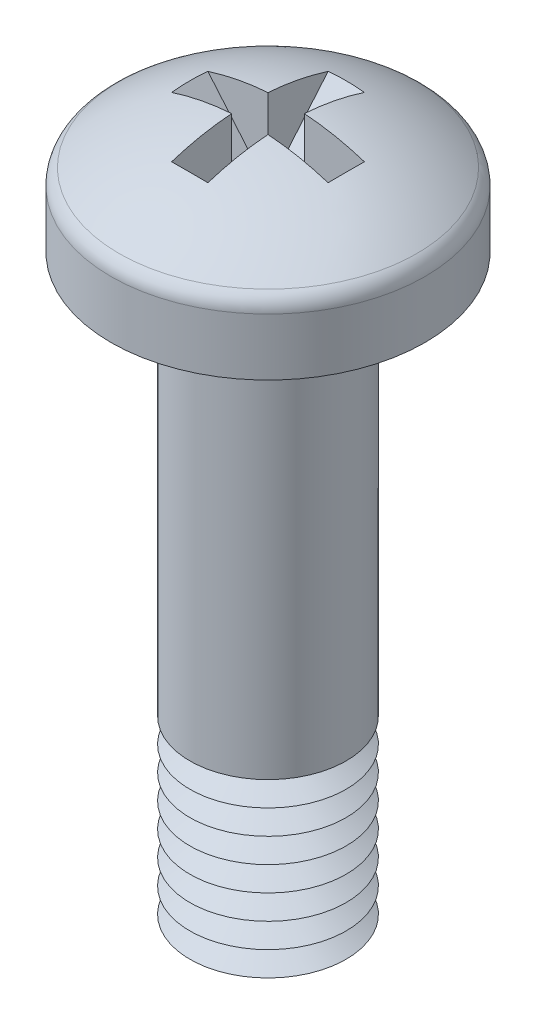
SolidWorks part; units mm, degrees
ref_plane "Front" through (0, 0, 0) normal (0, 0, 1) x (1, 0, 0)
ref_plane "Top" through (0, 0, 0) normal (0, 1, 0) x (1, 0, 0)
ref_plane "Side" through (0, 0, 0) normal (1, 0, 0) x (0, 0, -1)
sketch "Sketch1" plane through (0, 0, 0) normal (0, 0, 1) x (1, 0, 0)
  line L0 (0, 0) -> (4.0208, 0)
  line L1 (4.0208, 0) -> (4.0208, 1.4629)
  line L2 (0, 3.1) -> (0, 0)
  line L3 (0, 0) -> (0, 100) construction
  arc A0 (4.0208, 1.4629) -> (3.8128, 1.8691) centre (3.52, 1.4629) ccw
  arc A1 (3.8128, 1.8691) -> (0, 3.1) centre (0, -3.4208) ccw
revolve "Base-Revolve" add sketch "Sketch1" angle 360 about L3
sketch "Sketch2" plane through (0, 0, 0) normal (0, 0, 1) x (1, 0, 0)
  line L0 (0, 0) -> (0, 100) construction
  line L1 (0, -15) -> (1.456, -15)
  line L2 (1.456, -15) -> (2, -14.6859)
  line L3 (2, -14.6859) -> (1.456, -14.3718)
  line L4 (1.456, -14.3718) -> (2, -14.0577)
  line L5 (2, -14.0577) -> (1.456, -13.7436)
  line L6 (1.456, -13.7436) -> (2, -13.4295)
  line L7 (2, -13.4295) -> (1.456, -13.1154)
  line L8 (1.456, -13.1154) -> (2, -12.8012)
  line L9 (2, -12.8012) -> (1.456, -12.4871)
  line L10 (1.456, -12.4871) -> (2, -12.173)
  line L11 (2, -12.173) -> (1.456, -11.8589)
  line L12 (1.456, -11.8589) -> (2, -11.5448)
  line L13 (2, -11.5448) -> (1.456, -11.2307)
  line L14 (1.456, -11.2307) -> (2, -10.9166)
  line L15 (2, -10.9166) -> (1.456, -10.6025)
  line L16 (1.456, -10.6025) -> (2, -10.2884)
  line L17 (2, -10.2884) -> (2, 0)
  line L18 (2, 0) -> (0, 0)
  line L19 (0, 0) -> (0, -15)
revolve "Boss-Revolve1" add sketch "Sketch2" angle 360 about L0
sketch "Sketch3" plane through (0, 0, 0) normal (0, 0, 1) x (1, 0, 0)
  line L0 (-2.285, 4.65) -> (2.285, 4.65)
  line L1 (2.285, 4.65) -> (2.285, 3.1)
  line L2 (2.285, 3.1) -> (0, 0.4)
  line L3 (0, 0.4) -> (-2.285, 3.1)
  line L4 (-2.285, 3.1) -> (-2.285, 4.65)
extrude "Cut-Extrude1" cut sketch "Sketch3" against normal mid plane 0.93
sketch "Sketch4" plane through (0, 0, 0) normal (1, 0, 0) x (0, 0, -1)
  line L0 (-2.285, 4.65) -> (2.285, 4.65)
  line L1 (2.285, 4.65) -> (2.285, 3.1)
  line L2 (2.285, 3.1) -> (0, 0.4)
  line L3 (0, 0.4) -> (-2.285, 3.1)
  line L4 (-2.285, 3.1) -> (-2.285, 4.65)
extrude "Cut-Extrude2" cut sketch "Sketch4" against normal mid plane 0.93
